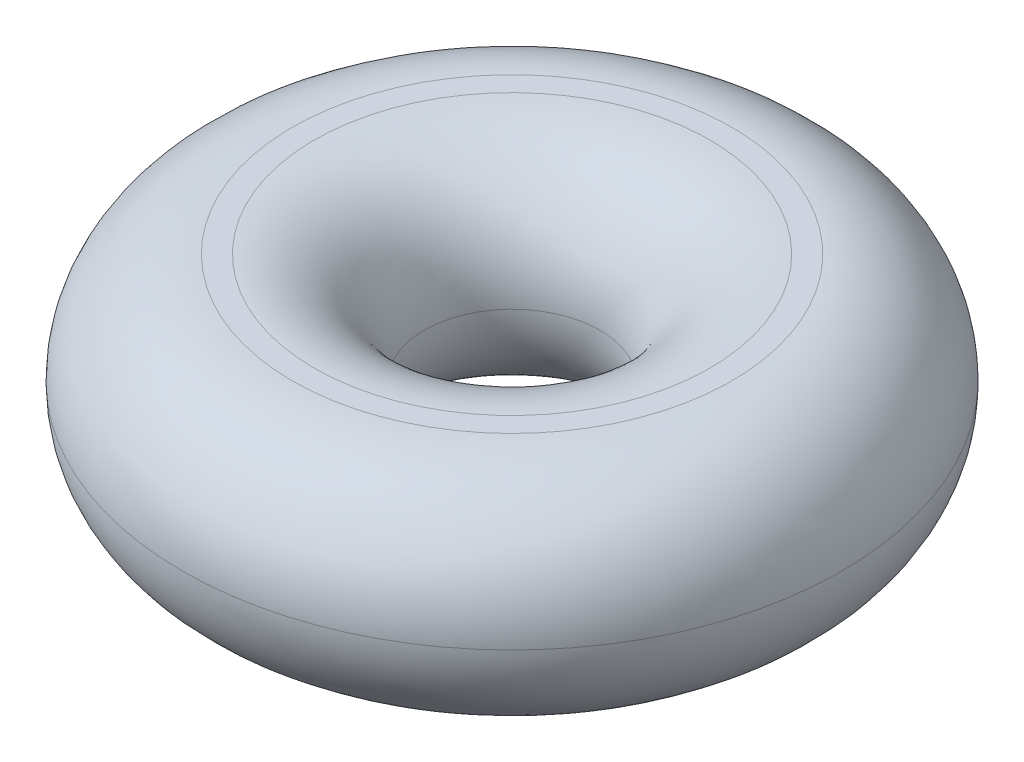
SolidWorks part; units mm, degrees
ref_plane "Front Plane" through (0, 0, 0) normal (0, 0, 1) x (1, 0, 0)
ref_plane "Top Plane" through (0, 0, 0) normal (0, 1, 0) x (1, 0, 0)
ref_plane "Right Plane" through (0, 0, 0) normal (1, 0, 0) x (0, 0, -1)
sketch "Sketch1" plane through (0, 0, 0) normal (0, 1, 0) x (1, 0, 0)
  circle A0 centre (0, 0) radius 22.5
  circle A1 centre (0, 0) radius 6
extrude "Boss-Extrude1" add sketch "Sketch1" along normal blind 15
fillet "Fillet1" radius 7.5 4 edges at (0, 0, 6) (0, 0, 22.5) (0, 15, 6) (0, 15, 22.5)
